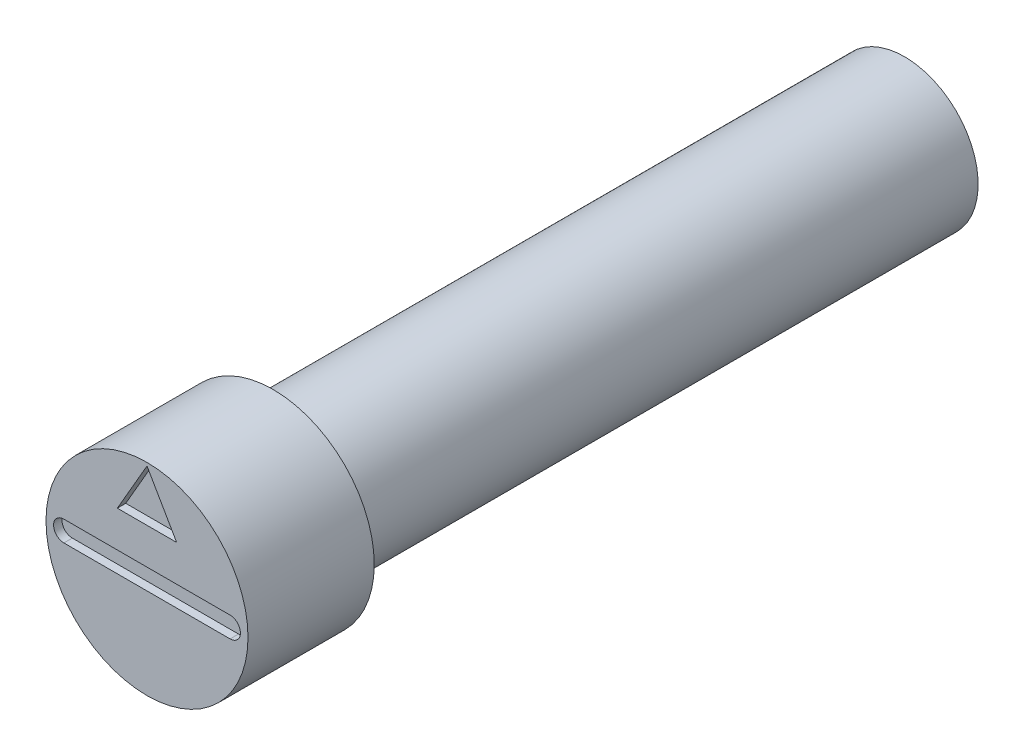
SolidWorks part; units mm, degrees
ref_plane "Front Plane" through (0, 0, 0) normal (0, 0, 1) x (1, 0, 0)
ref_plane "Top Plane" through (0, 0, 0) normal (0, 1, 0) x (1, 0, 0)
ref_plane "Right Plane" through (0, 0, 0) normal (1, 0, 0) x (0, 0, -1)
imported_body "Imported1"
other "DeleteFace1"
sketch "Sketch1" plane through (0, 0, 0) normal (0, 0, 1) x (1, 0, 0)
  line L0 (0, 2.3261) -> (-0.705, 1.105)
  line L1 (-0.705, 1.105) -> (0.705, 1.105)
  line L2 (0.705, 1.105) -> (0, 2.3261)
  line L4 (-1.975, 0.245) -> (1.975, 0.245)
  line L6 (-1.975, -0.245) -> (1.975, -0.245)
  arc A0 (-1.975, 0.245) -> (-1.975, -0.245) centre (-1.975, 0) ccw
  arc A1 (1.975, -0.245) -> (1.975, 0.245) centre (1.975, 0) ccw
  dimension "D2" = 4.44
  dimension "D3" = 2.22
  dimension "D1" = 0.49
  dimension "D4" = 1.41
  dimension "D5" = 60
  dimension "D6" = 60
  dimension "D7" = 0.86
  dimension "D8" = 0.245
extrude "Cut-Extrude1" cut sketch "Sketch1" against normal blind 0.2
